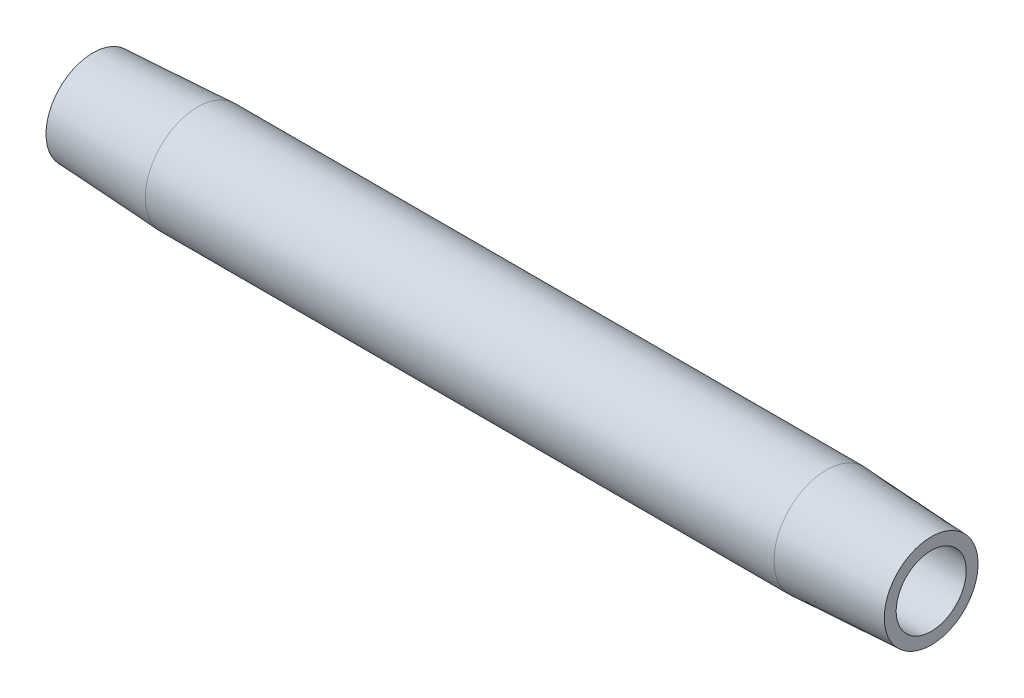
SolidWorks part; units mm, degrees
ref_plane "Front Plane" through (0, 0, 0) normal (0, 0, 1) x (1, 0, 0)
ref_plane "Top Plane" through (0, 0, 0) normal (0, 1, 0) x (1, 0, 0)
ref_plane "Right Plane" through (0, 0, 0) normal (1, 0, 0) x (0, 0, -1)
sketch "Sketch2" plane through (0, 0, 0) normal (0, 0, 1) x (1, 0, 0)
  line L0 (0.4761, 0) -> (50000.4761, 0) construction
  line L1 (0, -11.3625) -> (0, 49988.6375) construction
  line L7 (7.9375, 3.9687) -> (0, 3.5528)
  line L8 (55.5625, 3.9688) -> (7.9375, 3.9687)
  line L9 (63.5, 3.5528) -> (55.5625, 3.9688)
  line L10 (63.5, 2.6543) -> (63.5, 3.5528)
  line L11 (63.5, 2.6543) -> (0, 2.6543)
  line L12 (0, 3.5528) -> (0, 2.6543)
  dimension "D1" = 5.3086
  dimension "D2" = 7.9375
  dimension "D3" = 3
  dimension "D4" = 3
  dimension "D5" = 7.9375
  dimension "D6" = 7.9375
  dimension "D7" = 63.5
revolve "Revolve1" add sketch "Sketch2" angle 360 about L0
